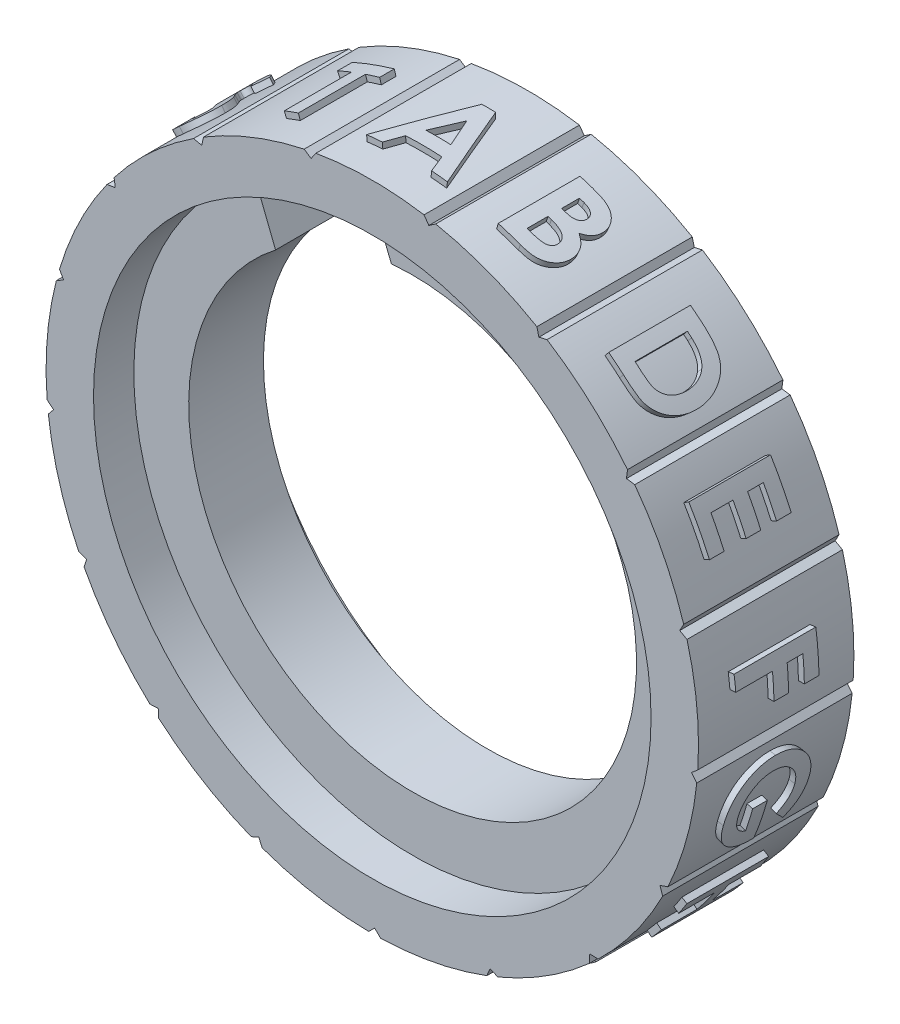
SolidWorks part; units mm, degrees
ref_plane "Front Plane" through (0, 0, 0) normal (0, 0, 1) x (1, 0, 0)
ref_plane "Top Plane" through (0, 0, 0) normal (0, 1, 0) x (1, 0, 0)
ref_plane "Right Plane" through (0, 0, 0) normal (1, 0, 0) x (0, 0, -1)
sketch "Sketch1" plane through (0, 0, 0) normal (0, 0, 1) x (1, 0, 0)
  circle A0 centre (0, 0) radius 13.97
  circle A1 centre (0, 0) radius 11.938
  dimension "D1" = 27.94
  dimension "D2" = 23.876
extrude "Boss-Extrude1" add sketch "Sketch1" along normal mid plane 6.6548
sketch "Sketch2" plane through (0, 0, 0) normal (0, 0, 1) x (1, 0, 0)
  line L0 (0, 0) -> (0, 7.4928) construction
  line L1 (-2.667, 7.4928) -> (2.667, 7.4928)
  line L3 (-2.667, 7.4928) -> (2.667, 7.4928)
  line L4 (-2.667, 7.4928) -> (-2.667, 12.4168)
  line L5 (-2.667, 12.4168) -> (2.667, 12.4168)
  line L6 (2.667, 7.4928) -> (2.667, 12.4168)
  circle A0 centre (0, 0) radius 9.5885
  circle A1 centre (0, 0) radius 12.7
  dimension "D1" = 19.177
  dimension "D4" = 25.4
  dimension "D2" = 5.334
  dimension "D3" = 4.924
extrude "Boss-Extrude2" add sketch "Sketch2" along normal mid plane 3.2004 contours L4 A1 L6 A0 | A0 L6 L5 L4
sketch "Sketch3" plane through (0, 0, 0) normal (0, 1, 0) x (1, 0, 0)
  text T0 "<b>A   B    D   E     F   G   H    I     K    L    M  N   O   P    R    S     T </b>" font "Century Gothic" height 3.5
wrap "Wrap1" sketch "Sketch3" wrap type emboss source sketch "Sketch3" thickness 0.254 parameters "D1"=0.254
sketch "Sketch4" plane through (0, 0, 0) normal (0, 0, 1) x (1, 0, 0)
  line L0 (0, 0) -> (-2.667, 13.7131) construction
  line L1 (-2.667, 13.7131) -> (2.667, 13.7131) construction
  line L2 (2.667, 13.7131) -> (0, 0) construction
  line L3 (-2.6185, 13.4637) -> (-2.9159, 13.6623)
  line L4 (-2.6185, 13.4637) -> (-2.4172, 13.7593)
  circle A0 centre (0, 0) radius 13.97 construction
  circle A1 centre (0, 0) radius 13.97
  dimension "D1" = 0.508
  dimension "D2" = 0.254
extrude "Cut-Extrude1" cut sketch "Sketch4" against normal mid plane 42.2148 contours L4 A1 L3
pattern_circular "CirPattern1" count 17 over 360 about axis through (0, 0, 0) along (0, 0, 1) of "Cut-Extrude1"
sketch "Sketch5" plane through (0, 0, 0) normal (0, 0, 1) x (1, 0, 0)
  line L0 (2.4798, 0.9815) -> (-2.4798, -0.9815)
  line L1 (-2.4798, -0.9815) -> (-6.7623, 9.838)
  line L3 (2.4798, 0.9815) -> (-1.8027, 11.8011)
  line L4 (-7.3053, 11.6086) -> (-2.6185, 13.4637)
  line L5 (-4.9619, 12.5362) -> (0, 0) construction
  circle A0 centre (0, 0) radius 11.938
  circle A1 centre (0, 0) radius 11.938 construction
  dimension "D2" = 5.334
  dimension "D1" = 5.334
  dimension "D3" = 11.6363
extrude "Cut-Extrude2" cut sketch "Sketch5" against normal mid plane 17.78
